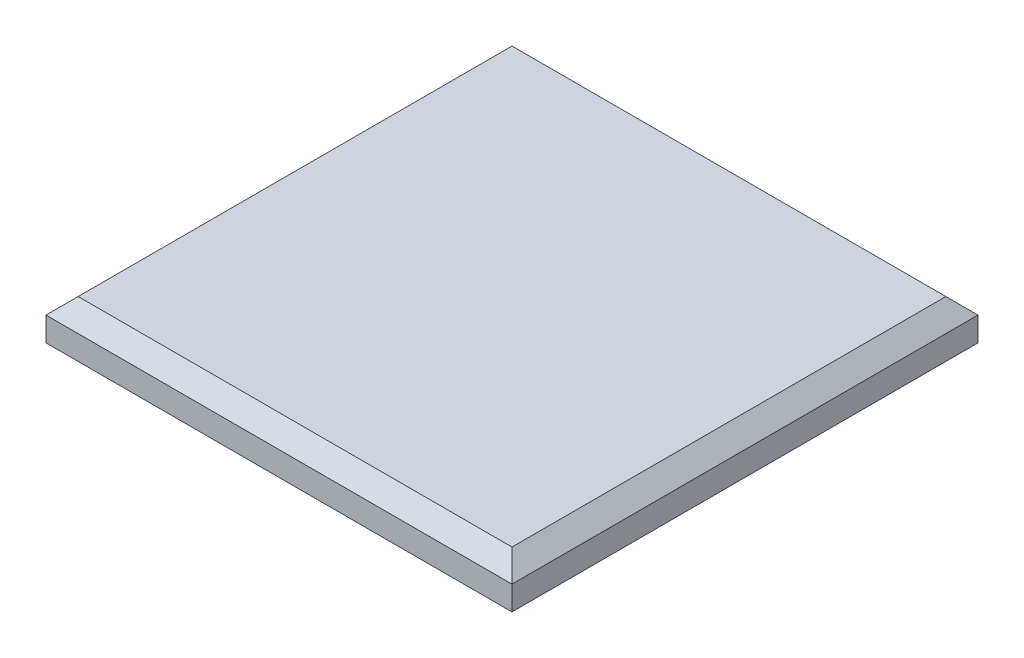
SolidWorks part; units mm, degrees
ref_plane "Front Plane" through (0, 0, 0) normal (0, 0, 1) x (1, 0, 0)
ref_plane "Top Plane" through (0, 0, 0) normal (0, 1, 0) x (1, 0, 0)
ref_plane "Right Plane" through (0, 0, 0) normal (1, 0, 0) x (0, 0, -1)
sketch "Sketch1" plane through (0, 0, 0) normal (0, 1, 0) x (1, 0, 0)
  line L1 (-145, 290) -> (145, 290)
  line L2 (-145, 290) -> (-145, 0)
  line L3 (-145, 0) -> (145, 0)
  line L4 (145, 290) -> (145, 0)
  dimension "D1" = 290
  dimension "D2" = 290
extrude "Boss-Extrude1" add sketch "Sketch1" along normal blind 25
chamfer "Chamfer1" distance 10 angle 45 4 edges at (0, 25, 0) (145, 25, -145) (0, 25, -290) (-145, 25, -145)
